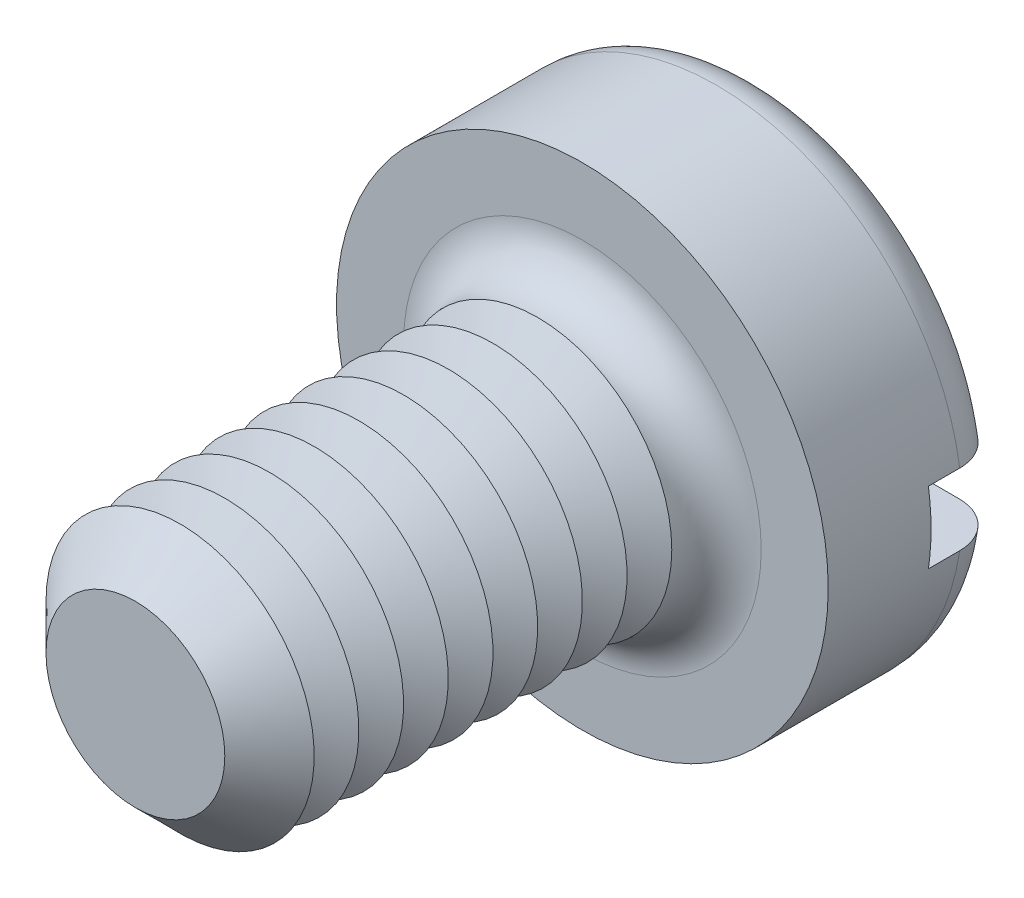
SolidWorks part; units mm, degrees
ref_plane "Front Plane" through (0, 0, 0) normal (0, 0, 1) x (1, 0, 0)
ref_plane "Top Plane" through (0, 0, 0) normal (0, 1, 0) x (1, 0, 0)
ref_plane "Right Plane" through (0, 0, 0) normal (1, 0, 0) x (0, 0, -1)
sketch "Sketch3" plane through (0, 0, 0) normal (0, 0, 1) x (1, 0, 0)
  circle A0 centre (0, 0) radius 2.75
  dimension "D1" = 5.5
extrude "Boss-Extrude2" add sketch "Sketch3" against normal blind 2
sketch "Sketch4" plane through (0, 0, 0) normal (0, 0, 1) x (1, 0, 0)
  circle A0 centre (0, 0) radius 1.5
  dimension "D1" = 3
extrude "Boss-Extrude3" add sketch "Sketch4" along normal blind 5
fillet "Fillet1" radius 0.5 2 edges at (2.75, 0, -2) (1.5, 0, 0)
chamfer "Chamfer1" distance 0.5 angle 45 1 edges at (1.5, 0, 5)
sketch "Sketch5" plane through (0, 0, 0) normal (1, 0, 0) x (0, 0, -1)
  line L0 (1.6944, 0) -> (-7.6738, 0) construction
sketch "Sketch6" plane through (0, 0, 0) normal (1, 0, 0) x (0, 0, -1)
  line L0 (-0.5, 1.5) -> (-0.75, 1.067)
  line L1 (-0.75, 1.067) -> (-1, 1.5)
  line L2 (-0.5, 1.5) -> (-4.5, 1.5) construction
  line L3 (-1, 1.5) -> (-0.5, 1.5)
  dimension "D1" = 0.5
revolve "Cut-Revolve1" cut sketch "Sketch6" angle 360 about L0
pattern_linear "LPattern1" count 8 spacing 0.5 along (0, 0, 1) of "Cut-Revolve1"
sketch "Sketch8" plane through (0, 0, -2) normal (0, 0, -1) x (-1, 0, 0)
  line L1 (2.75, -0.4) -> (-2.75, -0.4)
  line L2 (2.75, -0.4) -> (2.75, 0.4)
  line L3 (2.75, 0.4) -> (-2.75, 0.4)
  line L4 (-2.75, -0.4) -> (-2.75, 0.4)
  line L5 (2.75, -0.4) -> (-2.75, 0.4) construction
  line L6 (2.75, 0.4) -> (-2.75, -0.4) construction
  point P0 (0, 0)
  dimension "D1" = 5.5
  dimension "D2" = 0.8
extrude "Cut-Extrude1" cut sketch "Sketch8" against normal blind 0.85
